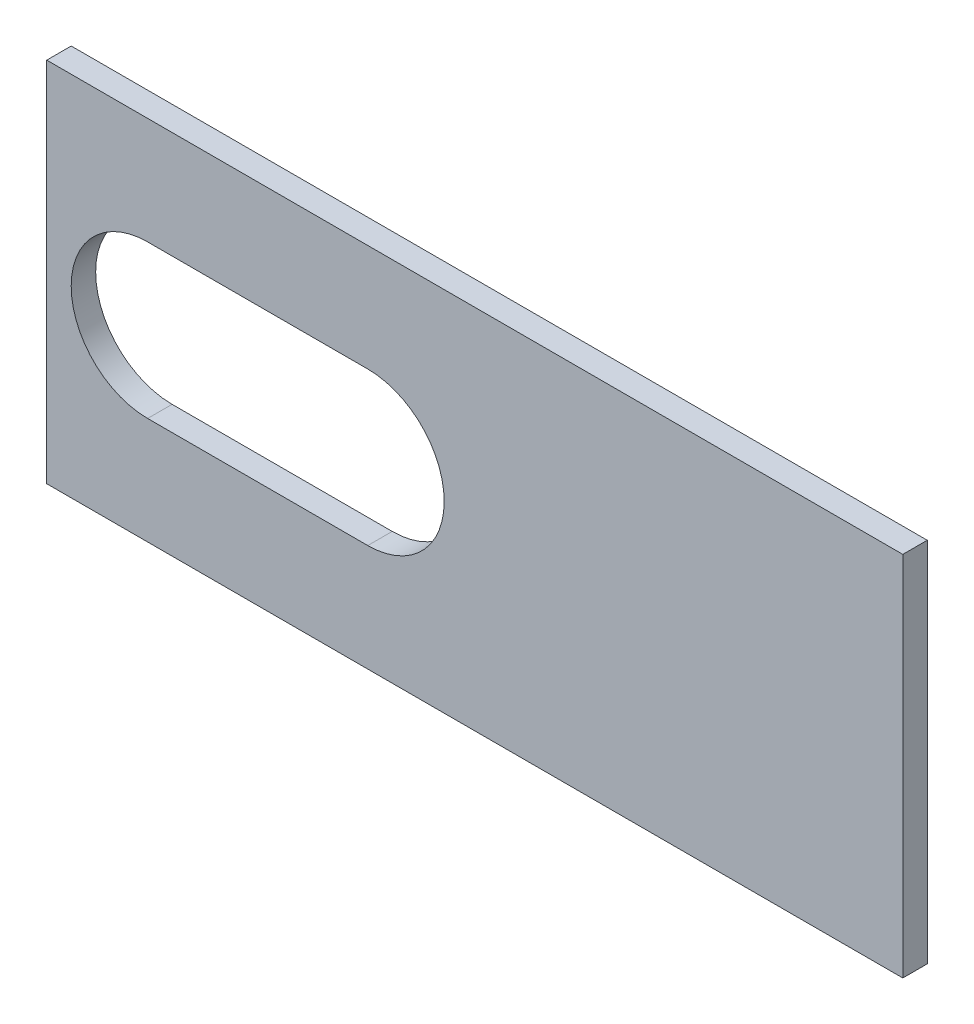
SolidWorks part; units mm, degrees
ref_plane "Ebene vorne" through (0, 0, 0) normal (0, 0, 1) x (1, 0, 0)
ref_plane "Ebene oben" through (0, 0, 0) normal (0, 1, 0) x (1, 0, 0)
ref_plane "Ebene rechts" through (0, 0, 0) normal (1, 0, 0) x (0, 0, -1)
sketch "Skizze1" plane through (0, 0, 0) normal (0, 0, 1) x (1, 0, 0)
  line L1 (-350, 150) -> (350, 150)
  line L2 (-350, 150) -> (-350, -150)
  line L3 (-350, -150) -> (350, -150)
  line L4 (350, 150) -> (350, -150)
  line L5 (-350, 150) -> (350, -150) construction
  line L6 (-350, -150) -> (350, 150) construction
  point P0 (0, 0)
  dimension "D1" = 300
  dimension "D2" = 700
extrude "Aufsatz-Linear austragen1" add sketch "Skizze1" along normal blind 20
sketch "Skizze3" plane through (0, 0, 20) normal (0, 0, 1) x (1, 0, 0)
  line L0 (350, 0) -> (-350, 0) construction
  line L1 (350, -150) -> (350, 150) construction
  line L2 (-350, 150) -> (-350, -150) construction
  line L3 (0, 150) -> (0, -150) construction
  line L4 (350, 150) -> (-350, 150) construction
  line L5 (-350, -150) -> (350, -150) construction
  line L6 (-267.5, 0) -> (-87.5, 0) construction
  line L7 (-267.5, 62.5) -> (-87.5, 62.5)
  line L8 (-267.5, -62.5) -> (-87.5, -62.5)
  line L9 (-330, 150) -> (-330, -150) construction
  line L10 (-25, 0) -> (-330, 0) construction
  arc A0 (-267.5, 62.5) -> (-267.5, -62.5) centre (-267.5, 0) ccw
  arc A1 (-87.5, -62.5) -> (-87.5, 62.5) centre (-87.5, 0) ccw
  point P14 (-177.5, 0)
  dimension "D1" = 305
  dimension "D2" = 125
  dimension "D3" = 20
extrude "Schnitt-Linear austragen1" cut sketch "Skizze3" against normal through all
